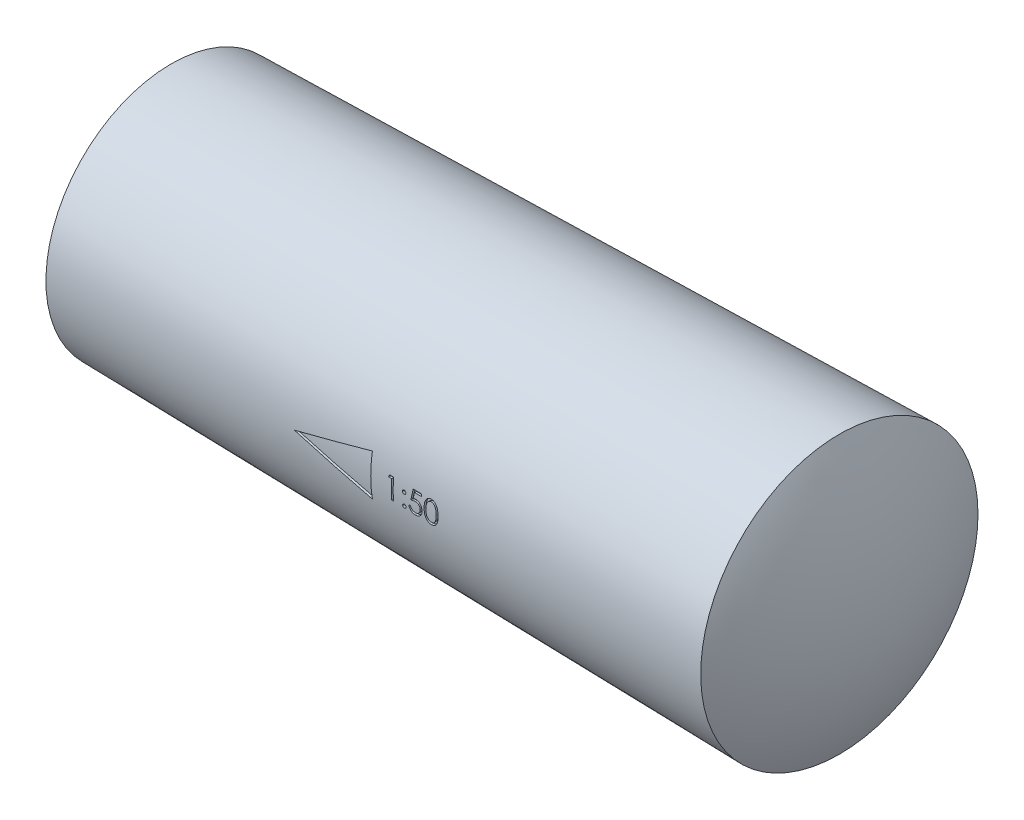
SolidWorks part; units mm, degrees
ref_plane "Front Plane" through (0, 0, 0) normal (0, 0, 1) x (1, 0, 0)
ref_plane "Top Plane" through (0, 0, 0) normal (0, 1, 0) x (1, 0, 0)
ref_plane "Right Plane" through (0, 0, 0) normal (1, 0, 0) x (0, 0, -1)
sketch "Sketch1" plane through (0, 0, 0) normal (1, 0, 0) x (0, 0, -1)
  circle A0 centre (0, 0) radius 6
  dimension "D1" = 12
extrude "Extrude1" add sketch "Sketch1" along normal mid plane 32
draft "Draft1" type of draft neutral plane draft angle 1.146 faces to draft 1 parameters "D1"=1.146
sketch "Sketch2" plane through (0, 0, 0) normal (0, 0, 1) x (1, 0, 0)
  line L0 (-16, 0) -> (-16, 6)
  line L1 (-16, 6) -> (-16, -6) construction
  line L2 (-16, 0) -> (-17.6, 0)
  line L3 (-17.6, 0) -> (-17.6, -6.32) construction
  line L4 (16, 0) -> (16, 6.64)
  line L5 (16, -6.64) -> (16, 6.64) construction
  line L6 (16, 0) -> (17.6, 0)
  line L7 (17.6, 0) -> (17.6, -6.32) construction
  line L8 (-16, -6) -> (16, -6.64) construction
  arc A0 (-17.6, 0) -> (-16, 6) centre (-5.55, 0) cw
  arc A1 (17.6, 0) -> (16, 6.64) centre (3.0219, 0) ccw
  point P14 (0, -6.32)
revolve "Revolve1" add sketch "Sketch2" angle 360 about L2
sketch "Sketch5" plane through (0, 0, 0) normal (0, 0, 1) x (1, 0, 0)
  line L0 (0, 6.32) -> (0, -6.32) construction
  line L1 (16, 6.64) -> (-16, 6) construction
  line L2 (-16, -6) -> (16, -6.64) construction
ref_plane "Plane2" through (0, 0, 0) normal (-0.02, 0, 0.9998) x (0.9998, 0, 0.02)
sketch "Sketch6" plane through (0, 0, 0) normal (-0.02, 0, 0.9998) x (0.9998, 0, 0.02)
  line L0 (0, 0) -> (0, 1)
  line L1 (0, 6.32) -> (0, -6.32) construction
  line L2 (0, 1) -> (-3.7321, 0)
  line L3 (-3.7321, 0) -> (0, -1)
  line L4 (0, -1) -> (0, 0)
  line L5 (0, -0.5) -> (4, -0.5) construction
  text T0 "1:50" font "Century Gothic" height 1
  dimension "D1" = 2
  dimension "D2" = 30
  dimension "D3" = 4
wrap "Wrap2" sketch "Sketch6" wrap type deboss source sketch "Sketch6" thickness 0.1 parameters "D1"=0.1
equation "\"D2@Sketch2\" = \"D1@Sketch2\""
